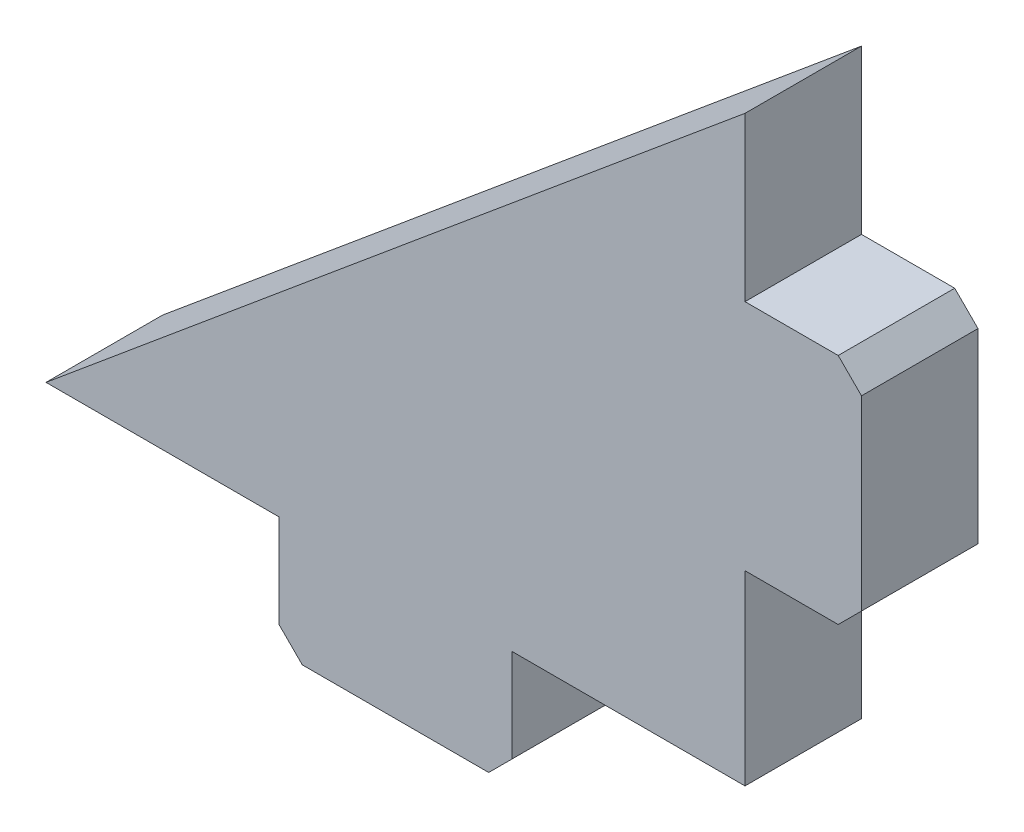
SolidWorks part; units mm, degrees
ref_plane "Plan de face" through (0, 0, 0) normal (0, 0, 1) x (1, 0, 0)
ref_plane "Plan de dessus" through (0, 0, 0) normal (0, 1, 0) x (1, 0, 0)
ref_plane "Plan de droite" through (0, 0, 0) normal (1, 0, 0) x (0, 0, -1)
sketch "Esquisse1" plane through (0, 0, 0) normal (0, 0, 1) x (1, 0, 0)
  line L0 (-30, 0) -> (-20, 0)
  line L1 (-20, 0) -> (-20, -5)
  line L2 (-20, -5) -> (-10, -5)
  line L3 (-10, -5) -> (-10, 0)
  line L4 (-10, 0) -> (0, 0)
  line L5 (0, 0) -> (0, 8)
  line L6 (0, 8) -> (5, 8)
  line L7 (5, 8) -> (5, 18)
  line L8 (5, 18) -> (0, 18)
  line L9 (0, 18) -> (0, 25)
  line L10 (0, 25) -> (-30, 0)
  dimension "D1" = 10
  dimension "D2" = 5
  dimension "D3" = 10
  dimension "D4" = 5
  dimension "D5" = 8
  dimension "D6" = 10
  dimension "D7" = 10
  dimension "D8" = 7
extrude "Boss.-Extru.1" add sketch "Esquisse1" along normal blind 5
chamfer "Chanfrein1" distance 1 angle 45 4 edges at (-10, -5, 2.5) (-20, -5, 2.5) (5, 18, 2.5) (5, 8, 2.5)
